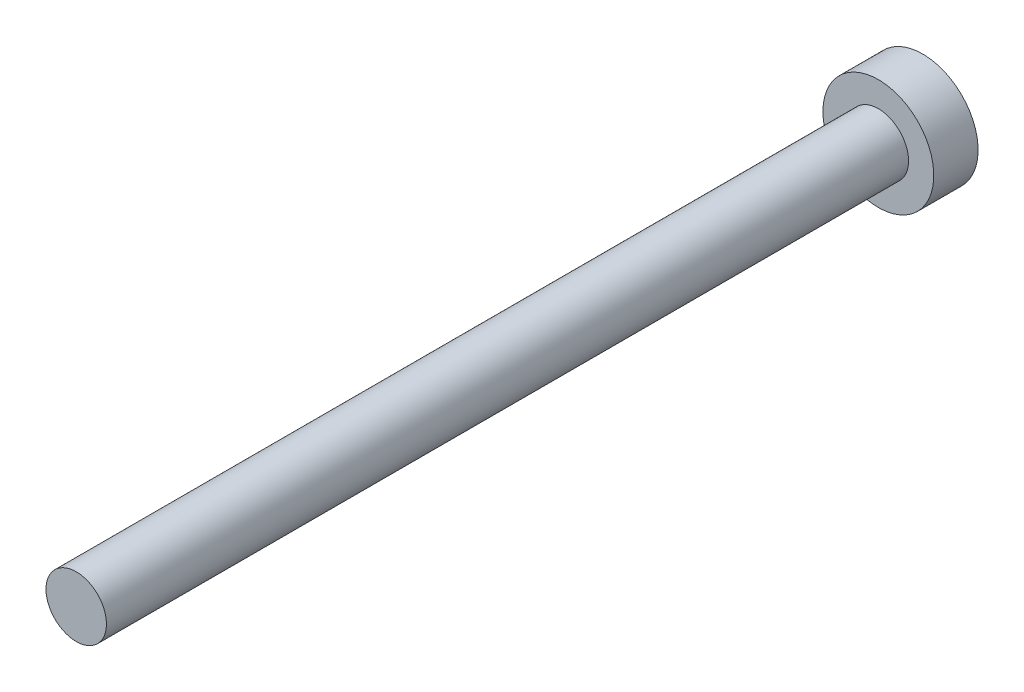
SolidWorks part; units mm, degrees
ref_plane "Front Plane" through (0, 0, 0) normal (0, 0, 1) x (1, 0, 0)
ref_plane "Top Plane" through (0, 0, 0) normal (0, 1, 0) x (1, 0, 0)
ref_plane "Right Plane" through (0, 0, 0) normal (1, 0, 0) x (0, 0, -1)
sketch "Sketch1" plane through (0, 0, 0) normal (0, 0, 1) x (1, 0, 0)
  circle A0 centre (0, 0) radius 1.5
  dimension "D1" = 3
extrude "Boss-Extrude1" add sketch "Sketch1" along normal blind 42
sketch "Sketch2" plane through (0, 0, 0) normal (0, 0, -1) x (-1, 0, 0)
  circle A0 centre (0, 0) radius 2.75
  dimension "D1" = 5.5
extrude "Boss-Extrude2" add sketch "Sketch2" against normal blind 2.2
scale "Escala1" scale about origin uniform scaling yes scale factor 1.5
